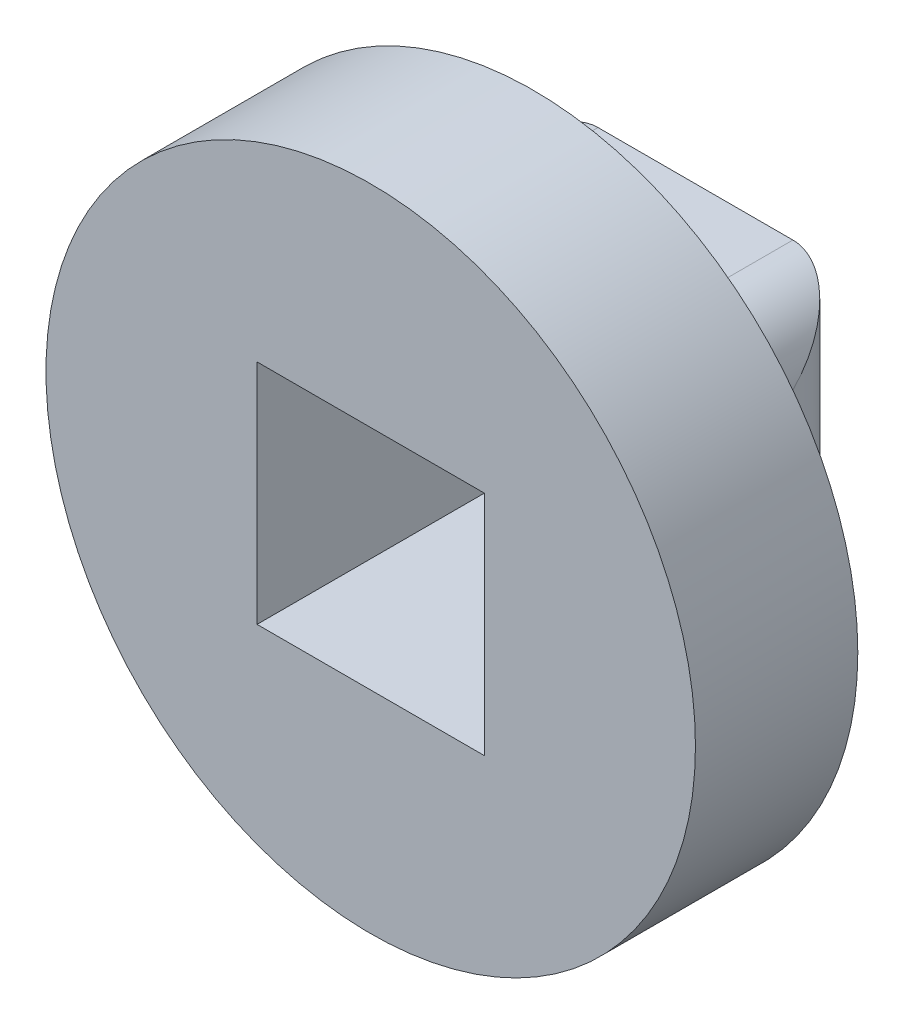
SolidWorks part; units mm, degrees
ref_plane "Ebene vorne" through (0, 0, 0) normal (0, 0, 1) x (1, 0, 0)
ref_plane "Ebene oben" through (0, 0, 0) normal (0, 1, 0) x (1, 0, 0)
ref_plane "Ebene rechts" through (0, 0, 0) normal (1, 0, 0) x (0, 0, -1)
sketch "Skizze1" plane through (0, 0, 0) normal (0, 0, 1) x (1, 0, 0)
  circle A0 centre (0, 0) radius 10
  dimension "D1" = 20
extrude "Aufsatz-Linear austragen1" add sketch "Skizze1" along normal blind 5
sketch "Skizze2" plane through (0, 0, 0) normal (0, 0, -1) x (-1, 0, 0)
  line L1 (-5, 5) -> (5, 5)
  line L2 (-5, 5) -> (-5, -5)
  line L3 (-5, -5) -> (5, -5)
  line L4 (5, 5) -> (5, -5)
  point P7 (-0.029, 1.249)
  dimension "D1" = 10
  dimension "D2" = 10
  dimension "D3" = 5
  dimension "D4" = 5
extrude "Aufsatz-Linear austragen2" add sketch "Skizze2" along normal blind 5
sketch "Skizze3" plane through (0, 0, -5) normal (0, 0, -1) x (-1, 0, 0)
  line L1 (-3.5, 3.5) -> (3.5, 3.5)
  line L2 (-3.5, 3.5) -> (-3.5, -3.5)
  line L3 (-3.5, -3.5) -> (3.5, -3.5)
  line L4 (3.5, 3.5) -> (3.5, -3.5)
  point P7 (0.668, 2.2946)
  dimension "D1" = 7
  dimension "D2" = 7
  dimension "D3" = 3.5
  dimension "D4" = 3.5
extrude "Schnitt-Linear austragen1" cut sketch "Skizze3" against normal blind 10 contours L2 L3 L4 L1
fillet "Verrundung1" radius 2 10 edges at (0, 5, 0) (0, -5, 0) (-5, -5, -2.5) (-5, 0, -5) (-5, 5, -2.5) (-5, 0, 0) (5, 5, -2.5) (5, 0, -5) (5, -5, -2.5) (5, 0, 0)
